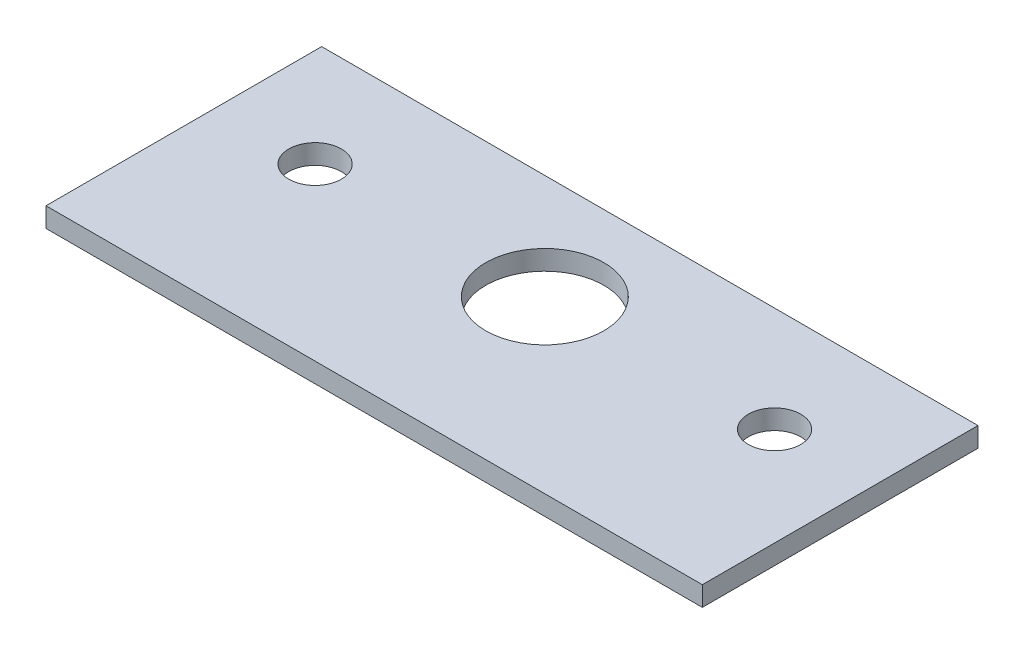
SolidWorks part; units mm, degrees
ref_plane "Plan de face" through (0, 0, 0) normal (0, 0, 1) x (1, 0, 0)
ref_plane "Plan de dessus" through (0, 0, 0) normal (0, 1, 0) x (1, 0, 0)
ref_plane "Plan de droite" through (0, 0, 0) normal (1, 0, 0) x (0, 0, -1)
sketch "Esquisse1" plane through (0, 0, 0) normal (0, 1, 0) x (1, 0, 0)
  line L0 (-50, 5) -> (50, 5) construction
  line L1 (-50, 21) -> (50, 21)
  line L2 (-50, 21) -> (-50, -21)
  line L3 (-50, -21) -> (50, -21)
  line L4 (50, 21) -> (50, -21)
  line L5 (-50, 21) -> (50, -21) construction
  line L6 (-50, -21) -> (50, 21) construction
  circle A0 centre (0, 5) radius 9
  circle A1 centre (35, 5) radius 4
  circle A2 centre (-35, 5) radius 4
  point P0 (0, 0)
  dimension "D4" = 8
  dimension "D5" = 18
  dimension "D1" = 100
  dimension "D2" = 42
  dimension "D3" = 26
  dimension "D6" = 35
  dimension "D7" = 35
extrude "Extrusion1" add sketch "Esquisse1" along normal blind 3
